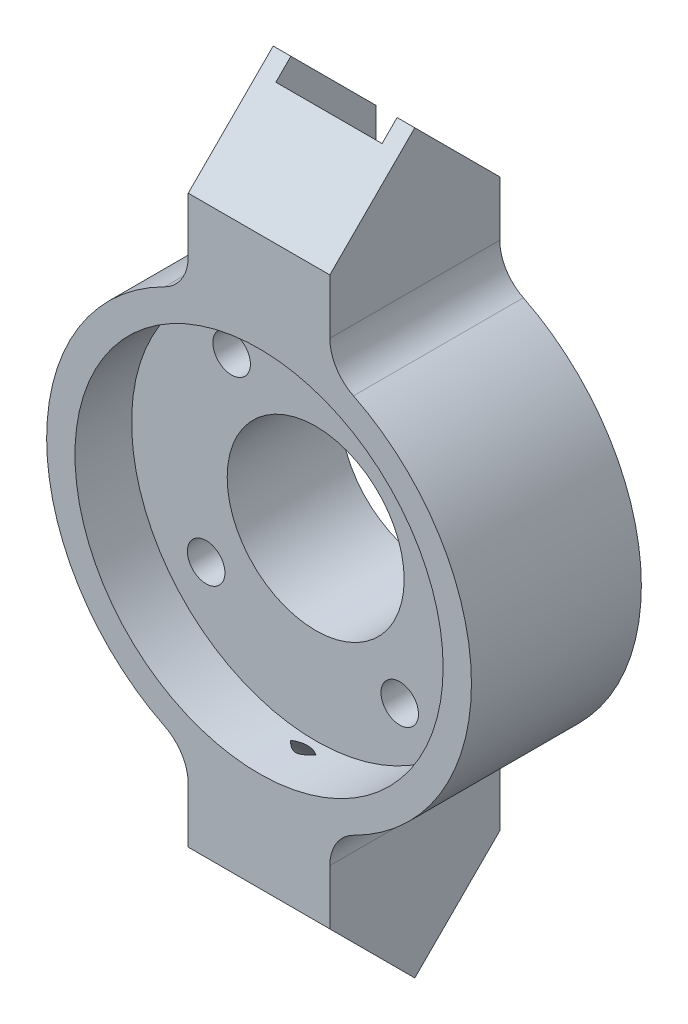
SolidWorks part; units mm, degrees
ref_plane "Plan de face" through (0, 0, 0) normal (0, 0, 1) x (1, 0, 0)
ref_plane "Plan de dessus" through (0, 0, 0) normal (0, 1, 0) x (1, 0, 0)
ref_plane "Plan de droite" through (0, 0, 0) normal (1, 0, 0) x (0, 0, -1)
sketch "Esquisse1" plane through (0, 0, 0) normal (0, 0, 1) x (1, 0, 0)
  circle A0 centre (0, 0) radius 60
extrude "Boss.-Extru.1" add sketch "Esquisse1" along normal blind 25.5
sketch "Esquisse2" plane through (0, 0, 25.5) normal (0, 0, 1) x (1, 0, 0)
  circle A0 centre (0, 0) radius 26
extrude "Enlèv. mat.-Extru.1" cut sketch "Esquisse2" against normal blind 8
sketch "Esquisse22" plane through (0, 0, 25.5) normal (0, 0, 1) x (1, 0, 0)
  line L0 (60, 0) -> (-60, 0) construction
  circle A0 centre (0, 0) radius 60 construction
  point P3 (40, 0)
  point P6 (-40, 0)
  dimension "D1" = 40
  dimension "D2" = 80
hole_wizard "Dégagement M62" positions "Esquisse26" profile "Esquisse25" hole size "M6" standard "ISO"
sketch "Esquisse26" plane through (0, 0, 25.5) normal (0, 0, 1) x (1, 0, 0)
  point P0 (-40, 0)
  point P1 (40, 0)
sketch "Esquisse25" plane through (-40, 0, 25.5) normal (1, 0, 0) x (0, -1, 0)
  line L0 (0, 0) -> (0, 28.9828)
  line L1 (0, 28.9828) -> (3.3, 27)
  line L2 (3.3, 27) -> (3.3, 0)
  line L5 (3.3, 0) -> (0, 0)
  line L10 (0, 28.9828) -> (-3.3, 27) construction
  line L11 (0, -6.35) -> (0, 107.95) construction
  dimension "Diamètre du perçage" = 6.6
  dimension "Profondeur du perçage" = 27
  dimension "Angle de pointe" = 118
sketch "Esquisse27" plane through (0, 0, 17.5) normal (0, 0, 1) x (1, 0, 0)
  line L0 (0, 0) -> (34.8109, 0) construction
  point P3 (19.5, 0)
  dimension "D1" = 19.5
hole_wizard "Diamètre du perçage Ø4.0 (4)2" positions "Esquisse31" profile "Esquisse30" hole size "Ø4.0" standard "ISO"
sketch "Esquisse31" plane through (0, 0, 17.5) normal (0, 0, 1) x (1, 0, 0)
  point P0 (19.5, 0)
sketch "Esquisse30" plane through (19.5, 0, 17.5) normal (1, 0, 0) x (0, -1, 0)
  line L0 (0, 0) -> (0, 11.2017)
  line L1 (0, 11.2017) -> (2, 10)
  line L2 (2, 10) -> (2, 0)
  line L5 (2, 0) -> (0, 0)
  line L10 (0, 11.2017) -> (-2, 10) construction
  line L11 (0, -6.35) -> (0, 107.95) construction
  dimension "Diamètre du perçage" = 4
  dimension "Profondeur du perçage" = 10
  dimension "Angle de pointe" = 118
sketch "Esquisse4" plane through (0, 0, 0) normal (0, 0, -1) x (-1, 0, 0)
  line L0 (0, 60) -> (0, -60) construction
  line L1 (60, 0) -> (-60, 0) construction
  line L2 (0, 0) -> (-15.4704, 11.8708) construction
  line L3 (0, 0) -> (11.8708, 15.4704) construction
  line L4 (0, 0) -> (-11.8708, -15.4704) construction
  line L5 (0, 0) -> (15.4704, -11.8708) construction
  circle A0 centre (0, 0) radius 19.5 construction
  circle A1 centre (0, 0) radius 60 construction
  point P10 (-19.5, 0)
  dimension "D1" = 52.5
  dimension "D2" = 90
  dimension "D3" = 90
  dimension "D4" = 90
sketch "Esquisse9" plane through (0, 0, 0) normal (0, 0, -1) x (-1, 0, 0)
  circle A0 centre (0, 0) radius 12.5
extrude "Enlèv. mat.-Extru.4" cut sketch "Esquisse9" against normal through all
hole_wizard "Diamètre du perçage Ø5.3 (5.3)1" positions "Esquisse6" profile "Esquisse5" hole size "Ø5.3" standard "ISO"
sketch "Esquisse6" plane through (0, 0, 0) normal (0, 0, -1) x (-1, 0, 0)
  point P0 (-15.4704, 11.8708)
  point P1 (-11.8708, -15.4704)
  point P4 (15.4704, -11.8708)
  point P7 (11.8708, 15.4704)
sketch "Esquisse5" plane through (15.4704, 11.8708, 0) normal (1, 0, 0) x (0, 1, 0)
  line L0 (0, 0) -> (0, 25.5)
  line L1 (0, 25.5) -> (2.65, 25.5)
  line L2 (2.65, 25.5) -> (2.65, 0)
  line L5 (2.65, 0) -> (0, 0)
  line L11 (0, -6.35) -> (0, 107.95) construction
  dimension "Diamètre du perçage jusqu'au prochain" = 5.3
  dimension "Profondeur du perçage jusqu'au prochain" = 25.5
sketch "Esquisse7" plane through (0, 0, 0) normal (0, 0, -1) x (-1, 0, 0)
  circle A0 centre (-15.4704, 11.8708) radius 5
  circle A1 centre (11.8708, 15.4704) radius 5
  circle A2 centre (-11.8708, -15.4704) radius 5
  circle A3 centre (15.4704, -11.8708) radius 5
extrude "Enlèv. mat.-Extru.3" cut sketch "Esquisse7" against normal blind 5
sketch "Esquisse11" plane through (0, 0, 0) normal (0, 0, -1) x (-1, 0, 0)
  circle A0 centre (0, 0) radius 60
extrude "Enlèv. mat.-Extru.6" cut sketch "Esquisse11" against normal blind 1.5
sketch "Esquisse12" plane through (0, 0, 1.5) normal (0, 0, -1) x (-1, 0, 0)
  line L0 (-10, 28.2843) -> (-10, 55)
  line L1 (-10, 55) -> (10, 55)
  line L2 (10, 55) -> (10, 28.2843)
  line L3 (-10, -28.2843) -> (-10, -55)
  line L4 (-10, -55) -> (10, -55)
  line L5 (10, -55) -> (10, -28.2843)
  line L6 (60, 0) -> (-60, 0) construction
  line L7 (0, 60) -> (0, -60) construction
  arc A0 (-10, 28.2843) -> (-10, -28.2843) centre (0, 0) ccw
  arc A1 (10, -28.2843) -> (10, 28.2843) centre (0, 0) ccw
  dimension "D1" = 110
  dimension "D2" = 55
  dimension "D3" = 10
  dimension "D4" = 20
  dimension "D5" = 20
extrude "Enlèv. mat.-Extru.7" cut sketch "Esquisse12" against normal through all flip side to cut
fillet "Congé2" radius 6 4 edges at (10, -28.2843, 13.5) (-10, -28.2843, 13.5) (-10, 28.2843, 13.5) (10, 28.2843, 13.5)
chamfer "Chanfrein2" distance 15 angle 45 1 edges at (0, 55, 1.5)
chamfer "Chanfrein3" distance 15 angle 45 1 edges at (0, -55, 1.5)
sketch "Esquisse14" plane through (0, 19.25, -19.25) normal (0, 0.7071, -0.7071) x (1, 0, 0)
  line L0 (-10, -50.5581) -> (-10, -29.3449) construction
  line L1 (7.5, -57.3449) -> (-7.5, -57.3449)
  line L2 (7.5, -57.3449) -> (7.5, -22.3449)
  line L3 (7.5, -22.3449) -> (-7.5, -22.3449)
  line L4 (-7.5, -57.3449) -> (-7.5, -22.3449)
  line L5 (-10, -29.3449) -> (10, -29.3449) construction
  dimension "D1" = 15
  dimension "D2" = 2.5
  dimension "D3" = 35
  dimension "D4" = 7
extrude "Enlèv. mat.-Extru.9" cut sketch "Esquisse14" against normal blind 3
sketch "Esquisse15" plane through (0, -19.25, -19.25) normal (0, -0.7071, -0.7071) x (1, 0, 0)
  line L0 (10, 29.3449) -> (-10, 29.3449) construction
  line L1 (-7.5, 57.3449) -> (7.5, 57.3449)
  line L2 (-7.5, 57.3449) -> (-7.5, 22.3449)
  line L3 (-7.5, 22.3449) -> (7.5, 22.3449)
  line L4 (7.5, 57.3449) -> (7.5, 22.3449)
  line L5 (10, 50.5581) -> (10, 29.3449) construction
  dimension "D1" = 15
  dimension "D2" = 35
  dimension "D3" = 7
  dimension "D4" = 2.5
extrude "Enlèv. mat.-Extru.10" cut sketch "Esquisse15" against normal blind 3
chamfer "Chanfrein4" distance 15 angle 45 1 edges at (0, 55, 25.5)
chamfer "Chanfrein5" distance 15 angle 45 1 edges at (0, -55, 25.5)
hole_wizard "Trou taraudé M101" positions "Esquisse17" profile "Esquisse16" tap size "M10" standard "ISO"
sketch "Esquisse17" plane through (0, -17.1287, -17.1287) normal (0, -0.7071, -0.7071) x (1, 0, 0)
  line L0 (-7.5, 46.3155) -> (-7.5, 26.3449) construction
  line L1 (7.5, 46.3155) -> (-7.5, 46.3155) construction
  point P0 (0, 35.8155)
  dimension "D1" = 7.5
  dimension "D2" = 10.5
sketch "Esquisse16" plane through (0, -42.4541, 8.1967) normal (1, 0, 0) x (0, 0.7071, -0.7071)
  line L0 (0, 0) -> (0, 22.0537)
  line L1 (0, 22.0537) -> (4.25, 19.5)
  line L2 (4.25, 19.5) -> (4.25, 0)
  line L5 (4.25, 0) -> (0, 0)
  line L10 (0, 22.0537) -> (-4.25, 19.5) construction
  line L11 (0, -6.35) -> (0, 107.95) construction
  dimension "Diamètre du trou pour taraudage" = 8.5
  dimension "Profondeur du trou pour taraudage" = 19.5
  dimension "Angle de pointe" = 118
hole_wizard "Trou taraudé M102" positions "Esquisse19" profile "Esquisse18" tap size "M10" standard "ISO"
sketch "Esquisse19" plane through (0, 17.1287, -17.1287) normal (0, 0.7071, -0.7071) x (-1, 0, 0)
  line L0 (7.5, 46.3155) -> (-7.5, 46.3155) construction
  line L1 (7.5, 26.3449) -> (7.5, 46.3155) construction
  point P0 (0, 35.8155)
  dimension "D1" = 10.5
  dimension "D2" = 7.5
sketch "Esquisse18" plane through (0, 42.4541, 8.1967) normal (1, 0, 0) x (0, 0.7071, 0.7071)
  line L0 (0, 0) -> (0, 22.0537)
  line L1 (0, 22.0537) -> (4.25, 19.5)
  line L2 (4.25, 19.5) -> (4.25, 0)
  line L5 (4.25, 0) -> (0, 0)
  line L10 (0, 22.0537) -> (-4.25, 19.5) construction
  line L11 (0, -6.35) -> (0, 107.95) construction
  dimension "Diamètre du trou pour taraudage" = 8.5
  dimension "Profondeur du trou pour taraudage" = 19.5
  dimension "Angle de pointe" = 118
chamfer "Chanfrein6" distance 0.5 angle 45 1 edges at (21.5, 0, 17.5)
sketch "Esquisse33" plane through (0, 0, 1.5) normal (0, 0, -1) x (-1, 0, 0)
  line L0 (10, -32.249) -> (10, -52)
  line L1 (10, -52) -> (-10, -52)
  line L2 (-10, -52) -> (-10, -32.249)
  line L3 (-10, 32.249) -> (-10, 52)
  line L4 (-10, 52) -> (10, 52)
  line L5 (10, 52) -> (10, 32.249)
  line L6 (10, 32.249) -> (10, 40) construction
  circle A0 centre (0, 0) radius 75
  arc A1 (-10, -32.249) -> (-13.3333, -26.8742) centre (-16, -32.249) ccw
  arc A2 (-13.3333, -26.8742) -> (-13.3333, 26.8742) centre (0, 0) cw
  arc A3 (-13.3333, 26.8742) -> (-10, 32.249) centre (-16, 32.249) ccw
  arc A4 (10, 32.249) -> (13.3333, 26.8742) centre (16, 32.249) ccw construction
  arc A5 (10, 32.249) -> (13.3333, 26.8742) centre (16, 32.249) ccw
  arc A6 (13.3333, 26.8742) -> (13.3333, -26.8742) centre (0, 0) cw
  arc A7 (13.3333, -26.8742) -> (13.3333, 26.8742) centre (0, 0) ccw construction
  arc A8 (13.3333, -26.8742) -> (10, -32.249) centre (16, -32.249) ccw
sketch "Esquisse34" plane through (0, 0, 1.5) normal (0, 0, -1) x (-1, 0, 0)
  line L0 (10, -32.249) -> (10, -52)
  line L1 (10, -40) -> (10, -32.249) construction
  line L2 (10, -52) -> (-10, -52)
  line L3 (-10, -52) -> (-10, -32.249)
  line L4 (-10, 32.249) -> (-10, 52)
  line L5 (-10, 52) -> (10, 52)
  line L6 (10, 52) -> (10, 32.249)
  arc A0 (13.3333, -26.8742) -> (10, -32.249) centre (16, -32.249) ccw construction
  arc A1 (-10, -32.249) -> (-13.3333, -26.8742) centre (-16, -32.249) ccw
  arc A2 (-13.3333, -26.8742) -> (-13.3333, 26.8742) centre (0, 0) cw
  arc A3 (-13.3333, 26.8742) -> (-10, 32.249) centre (-16, 32.249) ccw
  arc A4 (10, 32.249) -> (13.3333, 26.8742) centre (16, 32.249) ccw
  arc A5 (13.3333, 26.8742) -> (13.3333, -26.8742) centre (0, 0) cw
  arc A6 (13.3333, -26.8742) -> (10, -32.249) centre (16, -32.249) ccw
sketch "Esquisse35" plane through (0, 19.25, -19.25) normal (0, 0.7071, -0.7071) x (1, 0, 0)
  line L0 (-10, -46.3155) -> (-10, -29.3449) construction
  line L1 (10, -29.3449) -> (-10, -29.3449)
  line L2 (10, -29.3449) -> (10, -46.3155)
  line L3 (10, -46.3155) -> (-10, -46.3155)
  line L4 (-10, -29.3449) -> (-10, -46.3155)
  line L5 (-10, -46.3155) -> (-7.5, -46.3155) construction
sketch "Esquisse40" plane through (0, -19.25, -19.25) normal (0, -0.7071, -0.7071) x (1, 0, 0)
  line L0 (10, 46.3155) -> (10, 29.3449)
  line L1 (10, 29.3449) -> (-10, 29.3449)
  line L2 (-10, 29.3449) -> (-10, 46.3155)
  line L3 (-10, 46.3155) -> (10, 46.3155)
